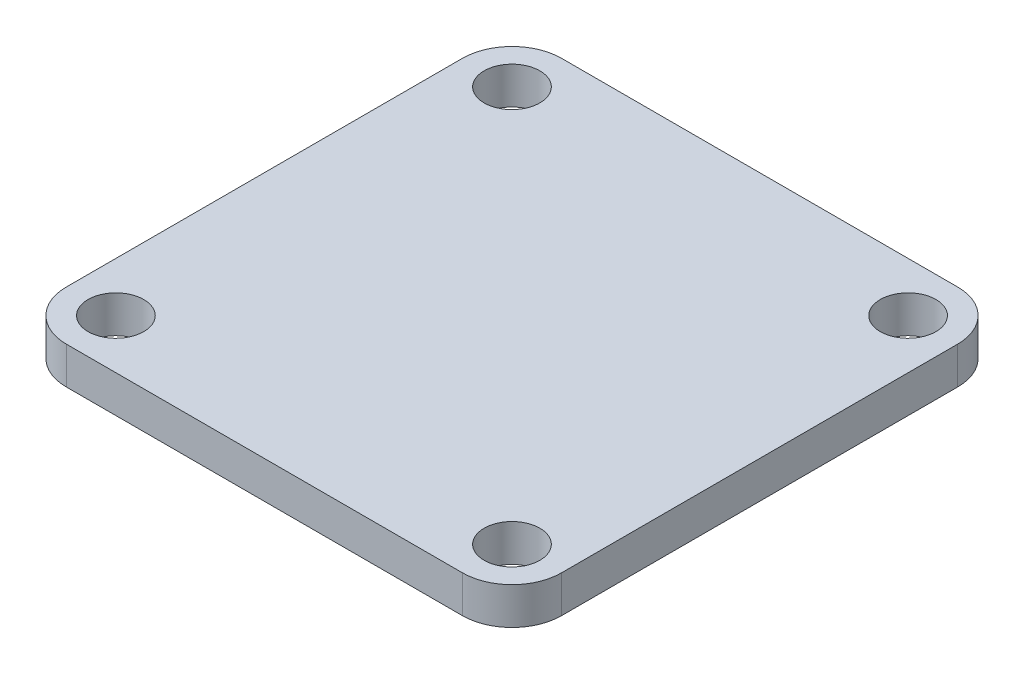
SolidWorks part; units mm, degrees
ref_plane "Front Plane" through (0, 0, 0) normal (0, 0, 1) x (1, 0, 0)
ref_plane "Top Plane" through (0, 0, 0) normal (0, 1, 0) x (1, 0, 0)
ref_plane "Right Plane" through (0, 0, 0) normal (1, 0, 0) x (0, 0, -1)
sketch "Sketch1" plane through (0, 0, 0) normal (0, 1, 0) x (1, 0, 0)
  line L1 (-16, 20) -> (16, 20)
  line L2 (-20, 16) -> (-20, -16)
  line L3 (-16, -20) -> (16, -20)
  line L4 (20, 16) -> (20, -16)
  arc A0 (-20, -16) -> (-16, -20) centre (-16, -16) ccw
  arc A1 (16, -20) -> (20, -16) centre (16, -16) ccw
  arc A2 (20, 16) -> (16, 20) centre (16, 16) ccw
  arc A3 (-16, 20) -> (-20, 16) centre (-16, 16) ccw
  circle A4 centre (-16, 16) radius 2.25
  circle A5 centre (16, 16) radius 2.25
  circle A6 centre (-16, -16) radius 2.25
  circle A7 centre (16, -16) radius 2.25
  point P6 (-20, -20)
  point P11 (20, 20)
  point P14 (-20, 20)
extrude "Boss-Extrude1" add sketch "Sketch1" along normal blind 3
equation "\"D5@Sketch1\"=\"D4@Sketch1\""
equation "\"D6@Sketch1\"=\"D4@Sketch1\""
equation "\"D7@Sketch1\"=\"D4@Sketch1\""
equation "\"D8@Sketch1\"=\"D2@Sketch1\"/2"
equation "\"D9@Sketch1\"=\"D2@Sketch1\"/2"
